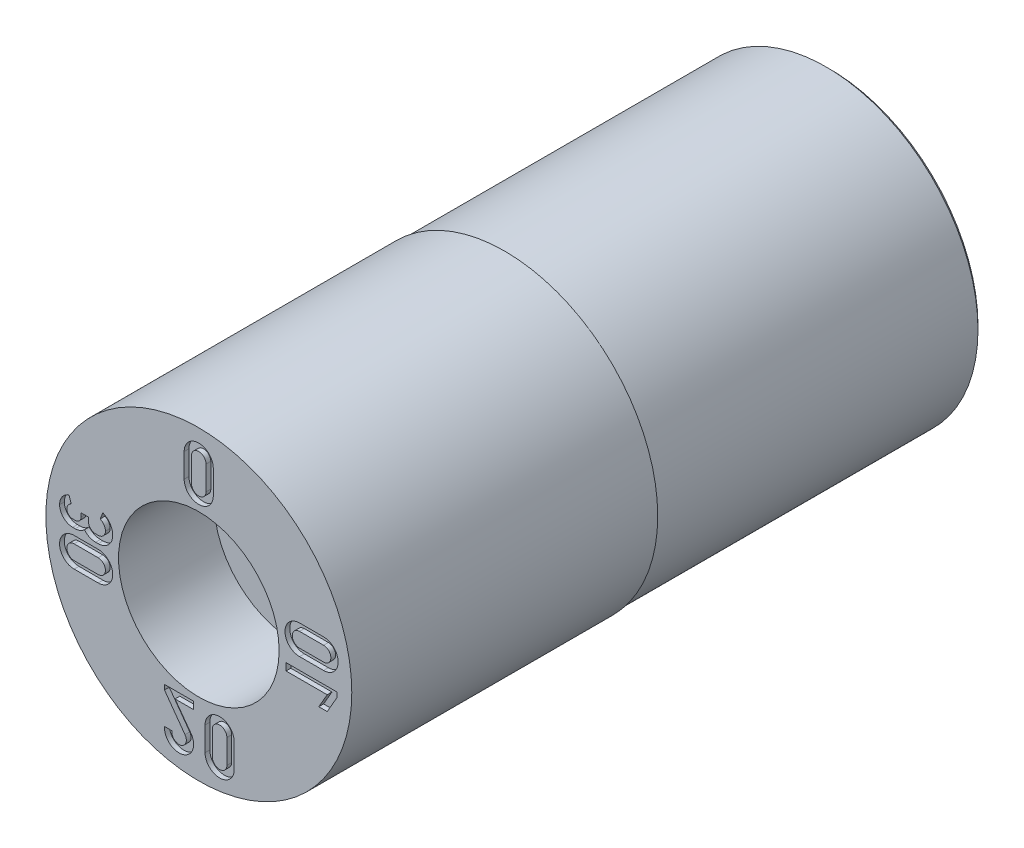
SolidWorks part; units mm, degrees
ref_plane "Front Plane" through (0, 0, 0) normal (0, 0, 1) x (1, 0, 0)
ref_plane "Top Plane" through (0, 0, 0) normal (0, 1, 0) x (1, 0, 0)
ref_plane "Right Plane" through (0, 0, 0) normal (1, 0, 0) x (0, 0, -1)
sketch "Sketch1" plane through (0, 0, 0) normal (1, 0, 0) x (0, 0, -1)
  line L2 (0, 8) -> (0, 4.2)
  line L3 (32.75, 8) -> (0, 8)
  line L4 (-3.7979, 0) -> (49996.2021, 0) construction
  line L8 (25, 1.75) -> (5, 1.75)
  line L9 (5, 4.2) -> (5, 1.75)
  line L10 (5, 4.2) -> (0, 4.2)
  line L12 (33, 4) -> (33, 7.75)
  line L16 (33, 7.75) -> (32.75, 8)
  line L17 (33, 4) -> (25, 4)
  line L18 (25, 1.75) -> (25, 4)
  dimension "D1" = 33
  dimension "D2" = 45
  dimension "D3" = 0.25
  dimension "D4" = 16
  dimension "D5" = 8.4
  dimension "D6" = 5
  dimension "D7" = 3.5
  dimension "D8" = 8
  dimension "D9" = 8
revolve "Revolve1" add sketch "Sketch1" angle 360 about L4
sketch "Sketch4" plane through (0, 0, 0) normal (1, 0, 0) x (0, 0, -1)
  line L0 (0, 0) -> (50000, 0) construction
  line L1 (33, -7.75) -> (33, 7.75) construction
  line L2 (16, 8.935) -> (33, 8.935)
  line L3 (16, 8.935) -> (16, 7.935)
  line L4 (16, 7.935) -> (33, 7.935)
  line L5 (33, 8.935) -> (33, 7.935)
  line L6 (32.75, 8) -> (0, 8) construction
  line L9 (0, 8.8) -> (0, -8.8) construction
  dimension "D1" = 1
  dimension "D2" = 0.065
  dimension "D3" = 16
revolve "Cut-Revolve1" cut sketch "Sketch4" angle 360 about L0
sketch "Sketch2" plane through (0, 0, 0) normal (0, 0, 1) x (1, 0, 0)
  line L1097 (0.7077, -5.2984) -> (0.7078, -6.5551)
  line L1098 (1.4693, -6.555) -> (1.4694, -5.2983)
  line L1099 (1.8503, -6.555) -> (1.8504, -5.2984)
  line L1100 (0.3268, -5.2985) -> (0.3269, -6.5551)
  line L1101 (-5.2642, 0.4968) -> (-5.3975, 0.4969)
  line L1102 (-5.7782, 0.8776) -> (-5.7781, 1.0679)
  line L1103 (-5.7781, 1.0679) -> (-6.159, 1.068)
  line L1104 (-6.159, 1.068) -> (-6.159, 0.8777)
  line L1105 (-6.4636, 0.5731) -> (-6.5969, 0.5731)
  line L1106 (-6.6685, 1.2024) -> (-6.7904, 1.5632)
  line L1107 (-6.5969, 0.1922) -> (-6.4637, 0.1922)
  line L1108 (-5.3975, 0.116) -> (-5.2642, 0.116)
  line L1109 (-5.0208, 1.6392) -> (-5.1606, 1.285)
  line L1110 (6.5249, 1.7922) -> (5.2683, 1.7921)
  line L1111 (5.2684, 0.2687) -> (6.525, 0.2688)
  line L1112 (5.2684, 0.6496) -> (6.525, 0.6497)
  line L1113 (6.5249, 1.4114) -> (5.2683, 1.4113)
  line L1114 (7.2269, -0.3553) -> (7.2269, -0.606)
  line L1115 (7.2269, -0.606) -> (6.7142, -1.4977)
  line L1116 (6.7142, -1.4977) -> (6.275, -1.4977)
  line L1117 (6.275, -1.4977) -> (6.7128, -0.7361)
  line L1118 (6.7128, -0.7361) -> (4.5614, -0.7363)
  line L1119 (4.5614, -0.7363) -> (4.5613, -0.3555)
  line L1120 (4.5613, -0.3555) -> (7.2269, -0.3553)
  line L1121 (-0.2726, -4.9027) -> (-0.2726, -4.5218)
  line L1122 (-0.2726, -4.5218) -> (-1.7958, -4.522)
  line L1123 (-1.7958, -4.522) -> (-1.7958, -4.7738)
  line L1124 (-1.7958, -4.7738) -> (-0.7249, -6.2603)
  line L1125 (-1.4105, -6.4258) -> (-1.7935, -6.4259)
  line L1126 (-0.4154, -6.0374) -> (-1.2437, -4.9028)
  line L1127 (-1.2437, -4.9028) -> (-0.2726, -4.9027)
  line L1128 (-0.7661, 6.5421) -> (-0.766, 5.2855)
  line L1129 (0.7572, 5.2855) -> (0.7573, 6.5422)
  line L1130 (0.3764, 5.2856) -> (0.3763, 6.5422)
  line L1131 (-0.3852, 6.5421) -> (-0.3853, 5.2855)
  line L1132 (-5.2652, -1.281) -> (-6.5218, -1.2807)
  line L1133 (-6.5218, -0.5192) -> (-5.2651, -0.5191)
  line L1134 (-6.5217, -0.1382) -> (-5.2651, -0.1383)
  line L1135 (-5.2652, -1.6617) -> (-6.5219, -1.6616)
  arc A514 (1.4694, -5.2983) -> (0.7077, -5.2984) centre (1.0886, -5.2984) ccw
  arc A515 (0.7078, -6.5551) -> (1.4693, -6.555) centre (1.0886, -6.555) ccw
  arc A516 (1.8504, -5.2984) -> (0.3268, -5.2985) centre (1.0886, -5.2984) ccw
  arc A517 (0.3269, -6.5551) -> (1.8503, -6.555) centre (1.0886, -6.555) ccw
  arc A518 (-4.8834, 0.8776) -> (-5.1606, 1.285) centre (-5.3214, 0.8776) ccw
  arc A519 (-5.2642, 0.4968) -> (-4.8834, 0.8776) centre (-5.2642, 0.8776) ccw
  arc A520 (-5.7782, 0.8776) -> (-5.3975, 0.4969) centre (-5.3975, 0.8776) ccw
  arc A521 (-6.4636, 0.5731) -> (-6.159, 0.8777) centre (-6.4636, 0.8777) ccw
  arc A522 (-6.9015, 0.8777) -> (-6.5969, 0.5731) centre (-6.5966, 0.878) ccw
  arc A523 (-6.6685, 1.2024) -> (-6.9015, 0.8777) centre (-6.5593, 0.878) ccw
  arc A524 (-6.7904, 1.5632) -> (-7.2823, 0.8778) centre (-6.5586, 0.8776) ccw
  arc A525 (-7.2823, 0.8778) -> (-6.5969, 0.1922) centre (-6.5969, 0.8776) ccw
  arc A526 (-6.4637, 0.1922) -> (-5.9823, 0.3898) centre (-6.4636, 0.8774) ccw
  arc A527 (-5.9823, 0.3898) -> (-5.3975, 0.116) centre (-5.3976, 0.8773) ccw
  arc A528 (-5.2642, 0.116) -> (-4.5027, 0.8775) centre (-5.2641, 0.8775) ccw
  arc A529 (-4.5027, 0.8775) -> (-5.0208, 1.6392) centre (-5.3216, 0.8775) ccw
  arc A530 (5.2683, 1.7921) -> (5.2684, 0.2687) centre (5.2684, 1.0304) ccw
  arc A531 (6.525, 0.2688) -> (6.5249, 1.7922) centre (6.525, 1.0305) ccw
  arc A532 (5.2683, 1.4113) -> (5.2684, 0.6496) centre (5.2684, 1.0304) ccw
  arc A533 (6.525, 0.6497) -> (6.5249, 1.4114) centre (6.525, 1.0305) ccw
  arc A534 (-1.4105, -6.4258) -> (-0.7249, -6.2603) centre (-1.0339, -6.483) ccw
  arc A535 (-1.7935, -6.4259) -> (-0.4154, -6.0374) centre (-1.0337, -6.4825) ccw
  arc A536 (-0.766, 5.2855) -> (0.7572, 5.2855) centre (-0.0044, 5.2855) ccw
  arc A537 (0.7573, 6.5422) -> (-0.7661, 6.5421) centre (-0.0044, 6.5421) ccw
  arc A538 (-0.3853, 5.2855) -> (0.3764, 5.2856) centre (-0.0044, 5.2855) ccw
  arc A539 (0.3763, 6.5422) -> (-0.3852, 6.5421) centre (-0.0044, 6.5421) ccw
  arc A540 (-5.2652, -1.281) -> (-5.2651, -0.5191) centre (-5.2652, -0.9) ccw
  arc A541 (-6.5218, -0.5192) -> (-6.5218, -1.2807) centre (-6.5218, -0.8999) ccw
  arc A542 (-5.2652, -1.6617) -> (-5.2651, -0.1383) centre (-5.2652, -0.9) ccw
  arc A543 (-6.5217, -0.1382) -> (-6.5219, -1.6616) centre (-6.5218, -0.8999) ccw
  point P2119 (0, 0.0122)
  point P2120 (0.0122, 0.0122)
  point P2121 (0.0122, 0)
extrude "Cut-Extrude1" cut sketch "Sketch2" against normal blind 0.25
sketch "Sketch3" plane through (0, 0, -5) normal (0, 0, 1) x (1, 0, 0)
  line L0 (0, 0) -> (0, 50000) construction
  line L1 (1.0104, 1.75) -> (-1.0104, 1.75)
  line L2 (-1.0104, 1.75) -> (-2.0207, 0)
  line L3 (-2.0207, 0) -> (-1.0104, -1.75)
  line L4 (-1.0104, -1.75) -> (1.0104, -1.75)
  line L5 (1.0104, -1.75) -> (2.0207, 0)
  line L6 (2.0207, 0) -> (1.0104, 1.75)
  line L7 (0, 0) -> (50000, 0) construction
  circle A0 centre (0, 0) radius 1.75 construction
  circle A1 centre (0, 0) radius 1.75 construction
extrude "Cut-Extrude2" cut sketch "Sketch3" against normal blind 4
